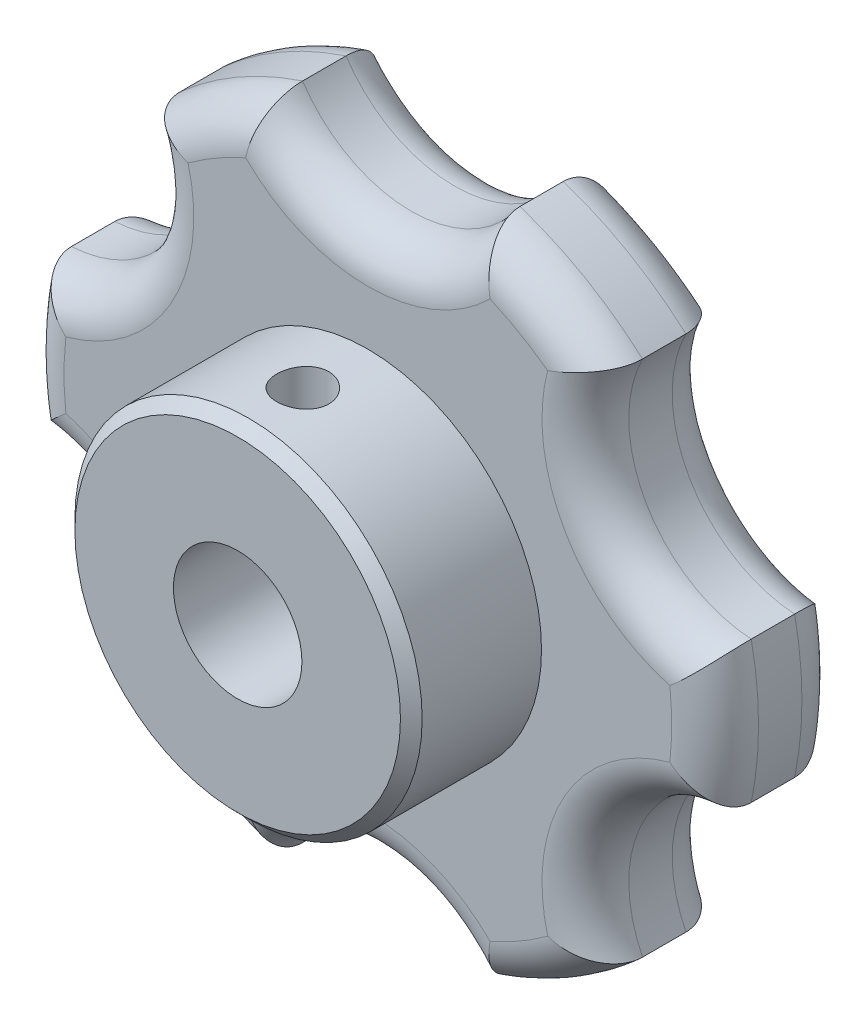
SolidWorks part; units mm, degrees
ref_plane "Plane1" through (0, 0, 0) normal (0, 0, 1) x (1, 0, 0)
ref_plane "Plane2" through (0, 0, 0) normal (0, 1, 0) x (1, 0, 0)
ref_plane "Plane3" through (0, 0, 0) normal (1, 0, 0) x (0, 0, -1)
sketch "Sketch1" plane through (0, 0, 0) normal (0, 0, 1) x (1, 0, 0)
  circle A0 centre (0, 0) radius 25.4
  dimension "D1" = 50.8
extrude "Base-Extrude" add sketch "Sketch1" along normal blind 9.525
sketch "Sketch2" plane through (0, 0, 0) normal (0, 0, 1) x (1, 0, 0)
  line L0 (0, 35.0152) -> (0, -15.7848) construction
  line L1 (-25.4, 0) -> (25.4, 0) construction
  circle A0 centre (0, 29.3687) radius 9.525
  dimension "D1" = 19.05
  dimension "D2" = 29.3687
extrude "Cut-Extrude1" cut sketch "Sketch2" along normal through all
pattern_circular "CirPattern1" count 6 every 60 about axis through (0, 0, 0) along (0, 0, 1) of "Cut-Extrude1"
fillet "Fillet1" radius 3.175 12 edges at (12.7, 21.997, 9.525) (17.1852, 9.9219, 9.525) (25.4, 0, 9.525) (17.1852, -9.9219, 9.525) (12.7, -21.997, 9.525) (0, -19.8438, 9.525) (-12.7, -21.997, 9.525) (-17.1852, -9.9219, 9.525) (-25.4, 0, 9.525) (-17.1852, 9.9219, 9.525) (-12.7, 21.997, 9.525) (0, 19.8438, 9.525)
fillet "Fillet2" radius 3.175 12 edges at (12.7, 21.997, 0) (17.1852, 9.9219, 0) (25.4, 0, 0) (17.1852, -9.9219, 0) (12.7, -21.997, 0) (0, -19.8438, 0) (-12.7, -21.997, 0) (-17.1852, -9.9219, 0) (-25.4, 0, 0) (-12.7, 21.997, 0) (-17.1852, 9.9219, 0) (0, 19.8438, 0)
sketch "Sketch3" plane through (0, 0, 9.525) normal (0, 0, 1) x (1, 0, 0)
  circle A0 centre (0, 0) radius 12.7
  dimension "D1" = 25.4
extrude "Boss-Extrude1" add sketch "Sketch3" along normal blind 9.525
chamfer "Chamfer1" distance 0.7937 angle 45 1 edges at (12.7, 0, 19.05)
ref_plane "Plane4" through (0, 12.7, 0) normal (0, 1, 0) x (-1, 0, 0)
sketch "Sketch4" plane through (0, 0, 0) normal (0, 1, 0) x (1, 0, 0)
  line L0 (0, -19.05) -> (0, -1.5875)
  line L1 (0, -6.35) -> (0, -3.175) construction
  line L2 (0, -1.5875) -> (4.699, -4.4109)
  line L3 (4.699, -4.4109) -> (4.699, -19.05)
  line L4 (0, -19.05) -> (4.699, -19.05)
  line L5 (8.9395, 0) -> (-8.9395, 0) construction
  line L6 (11.9062, -19.05) -> (-11.9062, -19.05) construction
  line L7 (0, -24.5113) -> (0, 6.6844) construction
  dimension "D1" = 4.699
  dimension "D2" = 59
  dimension "D3" = 1.5875
revolve "Cut-Revolve1" cut sketch "Sketch4" angle 360 about L7
sketch "Sketch5" plane through (0, 12.7, 0) normal (0, 1, 0) x (-1, 0, 0)
  line L0 (0, 6.35) -> (0, 3.175) construction
  line L1 (-11.9062, 19.05) -> (11.9062, 19.05) construction
  circle A0 centre (0, 14.2875) radius 1.905
  dimension "D2" = 3.81
  dimension "D1" = 4.7625
extrude "Cut-Extrude2" cut sketch "Sketch5" against normal up to next
